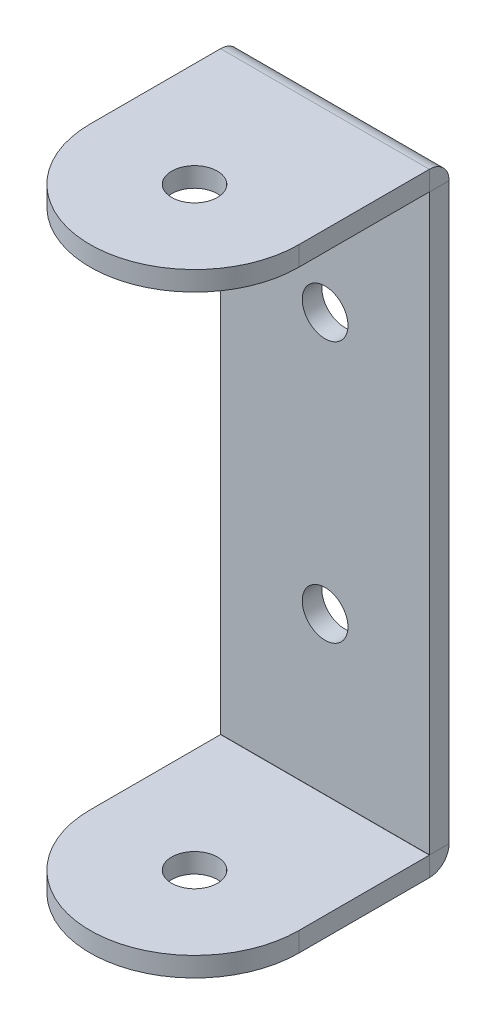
SolidWorks part; units mm, degrees
ref_plane "Front Plane" through (0, 0, 0) normal (0, 0, 1) x (1, 0, 0)
ref_plane "Top Plane" through (0, 0, 0) normal (0, 1, 0) x (1, 0, 0)
ref_plane "Right Plane" through (0, 0, 0) normal (1, 0, 0) x (0, 0, -1)
sketch "Sketch1" plane through (0, 0, 0) normal (0, 0, 1) x (1, 0, 0)
  line L0 (0, 0) -> (0, 64) construction
  line L1 (8, 64) -> (8, 0)
  line L2 (-8, 0) -> (-8, 64)
  line L3 (8, 32) -> (-8, 32) construction
  arc A0 (8, 64) -> (-8, 64) centre (0, 64) ccw
  arc A1 (-8, 0) -> (8, 0) centre (0, 0) ccw
  circle A2 centre (0, 42) radius 1.75
  circle A3 centre (0, 64) radius 1.75
  circle A5 centre (0, 22) radius 1.75
  circle A6 centre (0, 0) radius 1.75
  dimension "D1" = 3.5
  dimension "D2" = 22
  dimension "D3" = 22
  dimension "D6" = 8
  dimension "D4" = 10
sheet metal parameters "Sheet-Metal1" thickness 1.5 parameters "D1"=1
base flange "Base-Flange1" sketch "Sketch1" thickness 1.5 reverse thickness direction yes parameters "D1"=1
sketch "Sketch3" plane through (0, 0, 1.5) normal (0, 0, 1) x (1, 0, 0)
  line L0 (-8, 54) -> (8, 54)
  line L1 (-8, 64) -> (-8, 0) construction
  line L2 (8, 0) -> (8, 64) construction
  line L3 (8, 10) -> (-8, 10)
  circle A0 centre (0, 64) radius 1.75 construction
  circle A1 centre (0, 0) radius 1.75 construction
  dimension "D1" = 10
  dimension "D2" = 10
sketched bend "Sketched Bend1" parameters "D1"=0.01
bend "SketchBend1" bend radius 0.01 bend angle 90 parameters "D5"=1
bend "SketchBend2" bend radius 0 bend angle 90 parameters "D5"=2
flat pattern "Flat-Pattern1"
sketch "Bend-Lines1" plane through (0, 0, 0) normal (0, 1, 0) x (-1, 0, 0)
bend of the flat pattern "Flatten-<SketchBend1>1"
bend of the flat pattern "Flatten-<SketchBend2>1"
